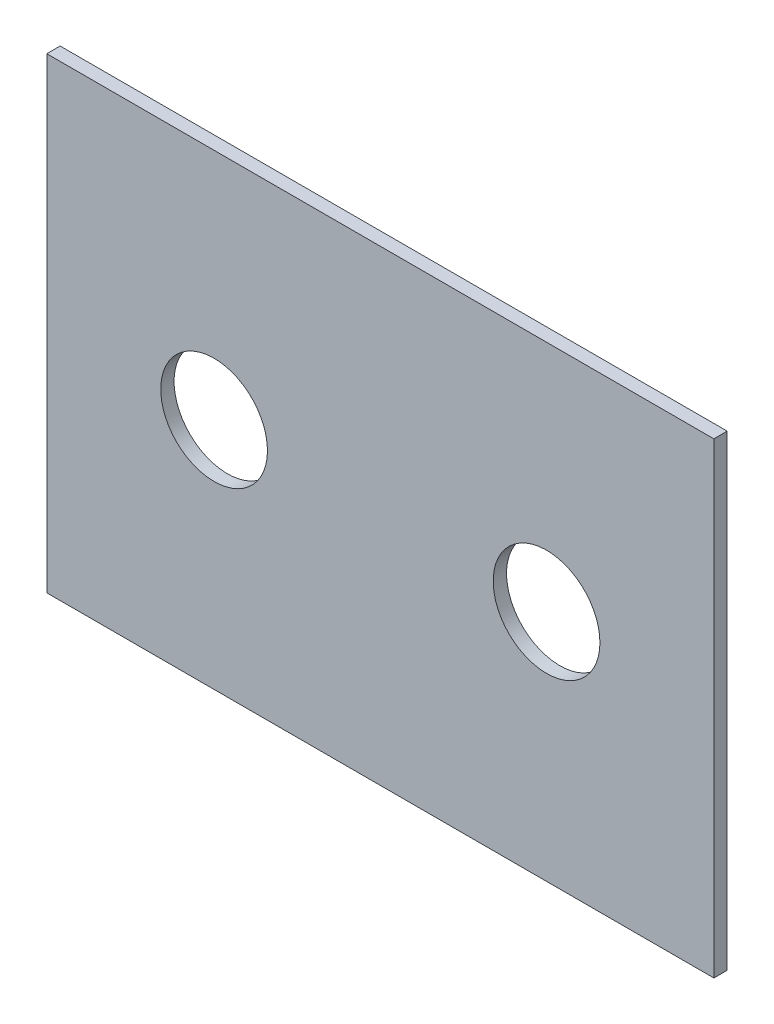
SolidWorks part; units mm, degrees
ref_plane "Piano frontale" through (0, 0, 0) normal (0, 0, 1) x (1, 0, 0)
ref_plane "Piano superiore" through (0, 0, 0) normal (0, 1, 0) x (1, 0, 0)
ref_plane "Piano destro" through (0, 0, 0) normal (1, 0, 0) x (0, 0, -1)
sketch "Schizzo1" plane through (0, 0, 0) normal (0, 0, 1) x (1, 0, 0)
  line L1 (-25, -17.5) -> (25, -17.5)
  line L2 (-25, -17.5) -> (-25, 17.5)
  line L3 (-25, 17.5) -> (25, 17.5)
  line L4 (25, -17.5) -> (25, 17.5)
  line L5 (-25, -17.5) -> (25, 17.5) construction
  line L6 (-25, 17.5) -> (25, -17.5) construction
  point P0 (0, 0)
  dimension "D1" = 50
  dimension "D2" = 35
extrude "Estrusione-Estrusione1" add sketch "Schizzo1" along normal blind 1
hole_wizard "Foro Ø8.0 (8)-1" positions "Schizzo3D1" profile "Schizzo2" hole size "Ø8.0" standard "ISO"
sketch3d "Schizzo3D1"
  line L0 (0, 0, 0) -> (0, 23.7277, 0) construction
  line L2 (0, 0, 0) -> (39.2177, 0, 0) construction
  line L4 (-25, -17.5, 1) -> (25, -17.5, 1) construction
  point P0 (-12.4599, 0, 1)
  point P2 (12.4599, 0, 1)
  point P16 (-30.2617, 7.1994, 0)
  dimension "D1" = 12.5
  dimension "D2" = 12.5
  dimension "D3" = 17.5
  dimension "D4" = 17.5
sketch "Schizzo2" plane through (-12.4599, 0, 1) normal (1, 0, 0) x (0, -1, 0)
  line L0 (0, 0) -> (0, 1)
  line L1 (0, 1) -> (4, 1)
  line L2 (4, 1) -> (4, 0)
  line L5 (4, 0) -> (0, 0)
  line L11 (0, -6.35) -> (0, 107.95) construction
  dimension "Thru Hole Dia." = 8
  dimension "Thru Hole Depth" = 1
